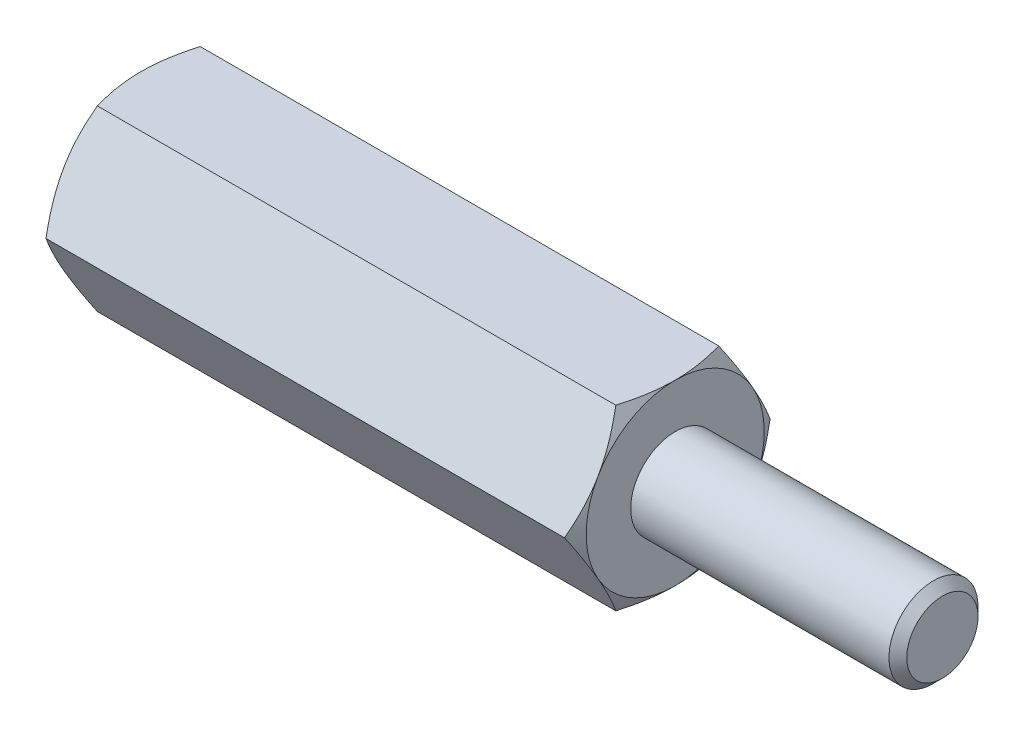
SolidWorks part; units mm, degrees
ref_plane "Front Plane" through (0, 0, 0) normal (0, 0, 1) x (1, 0, 0)
ref_plane "Top Plane" through (0, 0, 0) normal (0, 1, 0) x (1, 0, 0)
ref_plane "Right Plane" through (0, 0, 0) normal (1, 0, 0) x (0, 0, -1)
sketch "Sketch1" plane through (0, 0, 0) normal (1, 0, 0) x (0, 0, -1)
  line L1 (1.1547, 2) -> (-1.1547, 2)
  line L2 (-1.1547, 2) -> (-2.3094, 0)
  line L3 (-2.3094, 0) -> (-1.1547, -2)
  line L4 (-1.1547, -2) -> (1.1547, -2)
  line L5 (1.1547, -2) -> (2.3094, 0)
  line L6 (2.3094, 0) -> (1.1547, 2)
  circle A0 centre (0, 0) radius 2 construction
  dimension "D1" = 4
extrude "Extrude2" add sketch "Sketch1" along normal mid plane 12
sketch "Sketch2" plane through (0, 0, 0) normal (0, 0, 1) x (1, 0, 0)
  line L0 (-6, 2) -> (-4.5, 4.5981)
  line L1 (-6, 5) -> (-6, 2)
  line L3 (0, 0) -> (50000, 0) construction
  arc A0 (-4.5, 4.5981) -> (-6, 5) centre (-5.1962, 5) ccw
  dimension "D1" = 30
  dimension "D2" = 3
revolve "Cut-Revolve1" cut sketch "Sketch2" angle 360 about L3
mirror "Mirror1" about plane through (0, 0, 0) normal (1, 0, 0) of "Cut-Revolve1"
sketch "Sketch3" plane through (-6, 0, 0) normal (-1, 0, 0) x (0, 0, 1)
  circle A0 centre (0, 0) radius 0.8
  dimension "D1" = 1.6
extrude "Extrude3" cut sketch "Sketch3" against normal blind 6
sketch "Sketch4" plane through (0, 0, 0) normal (0, 0, 1) x (1, 0, 0)
  line L0 (0, 0) -> (0, 0.8)
  line L1 (5.8214, 0) -> (-5.8214, 0) construction
  line L2 (0, 0.8) -> (0.4619, 0)
  line L3 (0.4619, 0) -> (0, 0)
  line L4 (-6, 1) -> (-6, -1) construction
  point P4 (-6, 0)
  dimension "D1" = 30
  dimension "D2" = 0.8
  dimension "D3" = 6
revolve "Cut-Revolve2" cut sketch "Sketch4" angle 360 about L3
sketch "Sketch5" plane through (6, 0, 0) normal (1, 0, 0) x (0, 0, -1)
  circle A0 centre (0, 0) radius 1
  dimension "D1" = 2
extrude "Extrude4" add sketch "Sketch5" along normal blind 6
chamfer "Chamfer1" distance 0.2 angle 45 1 edges at (12, 0, -1)
equation "\"D2@Sketch4\" = \"D1@Sketch3\"/2"
